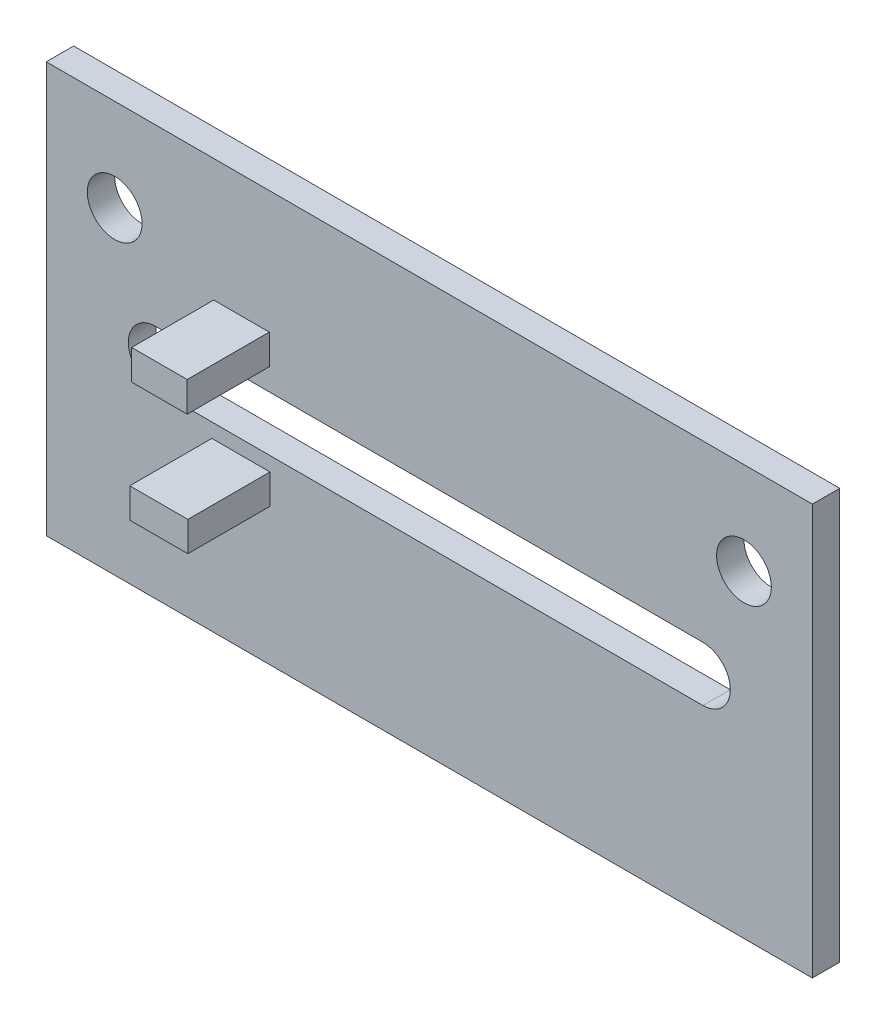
SolidWorks part; units mm, degrees
ref_plane "Plan de face" through (0, 0, 0) normal (0, 0, 1) x (1, 0, 0)
ref_plane "Plan de dessus" through (0, 0, 0) normal (0, 1, 0) x (1, 0, 0)
ref_plane "Plan de droite" through (0, 0, 0) normal (1, 0, 0) x (0, 0, -1)
sketch "Esquisse1" plane through (0, 0, 0) normal (0, 0, 1) x (1, 0, 0)
  line L0 (4, 8.6254) -> (24, 8.6254)
  line L1 (0, 0) -> (28, 0)
  line L2 (0, 0) -> (0, 15)
  line L3 (0, 15) -> (28, 15)
  line L4 (28, 0) -> (28, 15)
  line L5 (24, 6.6254) -> (4, 6.6254)
  circle A0 centre (2.5, 11.6254) radius 1
  circle A1 centre (25.5, 11.6254) radius 1
  arc A2 (4, 8.6254) -> (4, 6.6254) centre (4, 7.6254) ccw
  arc A3 (24, 6.6254) -> (24, 8.6254) centre (24, 7.6254) ccw
  dimension "D5" = 2
  dimension "D6" = 2
  dimension "D9" = 2
  dimension "D10" = 2
  dimension "D1" = 28
  dimension "D2" = 15
  dimension "D3" = 2.5
  dimension "D4" = 2.5
  dimension "D7" = 4
  dimension "D8" = 4
  dimension "D11" = 4
  dimension "D12" = 4
extrude "Boss.-Extru.1" add sketch "Esquisse1" along normal blind 1
sketch "Esquisse2" plane through (0, 0, 1) normal (0, 0, 1) x (1, 0, 0)
  line L1 (6.0514, 5.0173) -> (8.175, 5.0173)
  line L2 (6.0514, 5.0173) -> (6.0514, 6.1048)
  line L3 (6.0514, 6.1048) -> (8.175, 6.1048)
  line L4 (8.175, 5.0173) -> (8.175, 6.1048)
  line L5 (6.1196, 10.5189) -> (8.1497, 10.5189)
  line L6 (6.1196, 10.5189) -> (6.1196, 9.4209)
  line L7 (6.1196, 9.4209) -> (8.1497, 9.4209)
  line L8 (8.1497, 10.5189) -> (8.1497, 9.4209)
extrude "Boss.-Extru.2" add sketch "Esquisse2" along normal blind 3
